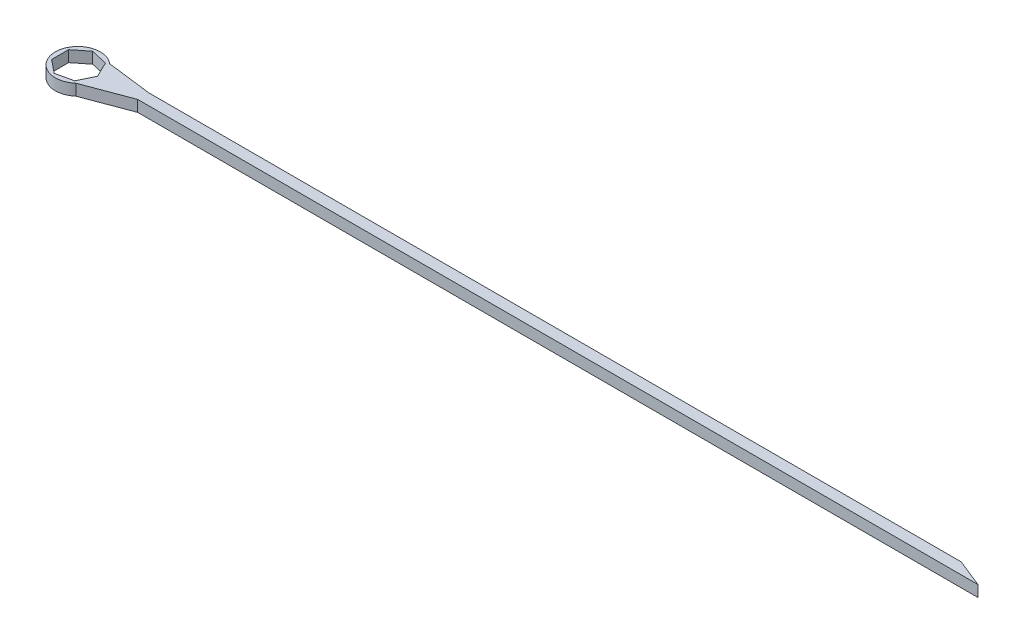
SolidWorks part; units mm, degrees
ref_plane "Front Plane" through (0, 0, 0) normal (0, 0, 1) x (1, 0, 0)
ref_plane "Top Plane" through (0, 0, 0) normal (0, 1, 0) x (1, 0, 0)
ref_plane "Right Plane" through (0, 0, 0) normal (1, 0, 0) x (0, 0, -1)
sketch "Sketch1" plane through (0, 0, 0) normal (0, 1, 0) x (1, 0, 0)
  line L0 (5.3229, 0) -> (80, 0)
  line L2 (1.75, 0) -> (1.0911, 1.3682)
  line L3 (1.0911, 1.3682) -> (-0.3894, 1.7061)
  line L4 (-0.3894, 1.7061) -> (-1.5767, 0.7593)
  line L5 (-1.5767, 0.7593) -> (-1.5767, -0.7593)
  line L6 (-1.5767, -0.7593) -> (-0.3894, -1.7061)
  line L7 (-0.3894, -1.7061) -> (1.0911, -1.3682)
  line L8 (1.0911, -1.3682) -> (1.75, 0)
  line L10 (80, 0) -> (77.5, 1)
  line L11 (77.5, 1) -> (5.3229, 1)
  line L12 (5.3229, 1) -> (1.3229, 1.5)
  line L13 (5.3229, 0) -> (1.3229, -1.5)
  arc A0 (1.3229, 1.5) -> (1.3229, -1.5) centre (0, 0) ccw
  circle A1 centre (0, 0) radius 1.75 construction
  dimension "D1" = 4
  dimension "D2" = 3.5
  dimension "D3" = 1
  dimension "D4" = 2.5
  dimension "D5" = 1.5
  dimension "D6" = 4
  dimension "D8" = 1.5
extrude "Boss-Extrude1" add sketch "Sketch1" along normal blind 1
sketch "Sketch2" plane through (0, 1, 0) normal (0, 1, 0) x (1, 0, 0)
  line L0 (0, 0) -> (16, 0)
  line L1 (5.3229, 0) -> (80, 0) construction
  line L2 (16, 0) -> (23.6429, 0)
  line L3 (23.6429, 0) -> (31.2857, 0)
  line L4 (31.2857, 0) -> (38.9286, 0)
  line L5 (38.9286, 0) -> (46.5714, 0)
  line L6 (46.5714, 0) -> (54.2143, 0)
  line L7 (54.2143, 0) -> (61.8571, 0)
  line L8 (61.8571, 0) -> (69.5, 0)
  line L10 (69.5, 0) -> (77.5, 0)
  dimension "D1" = 16
  dimension "D2" = 8
